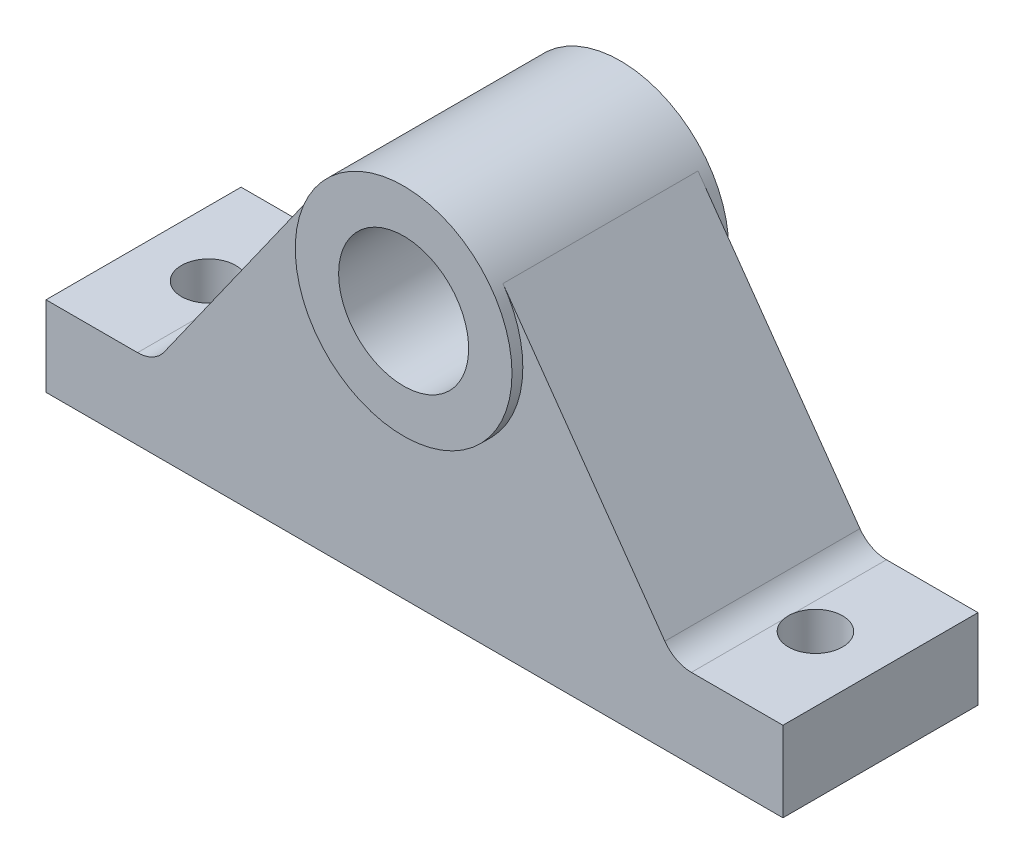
SolidWorks part; units mm, degrees
ref_plane "前视基准面" through (0, 0, 0) normal (0, 0, 1) x (1, 0, 0)
ref_plane "上视基准面" through (0, 0, 0) normal (0, 1, 0) x (1, 0, 0)
ref_plane "右视基准面" through (0, 0, 0) normal (1, 0, 0) x (0, 0, -1)
sketch "草图1" plane through (0, 0, 0) normal (0, 0, 1) x (1, 0, 0)
  line L0 (0, 0) -> (0, 164.8448) construction
  line L1 (-170, 0) -> (-120, 0)
  line L2 (-170, 0) -> (-170, -37)
  line L3 (-170, -37) -> (170, -37)
  line L4 (170, 0) -> (170, -37)
  line L5 (-40.8123, 111.8852) -> (-120, 0)
  line L6 (40.8123, 111.8852) -> (120, 0)
  line L7 (120, 0) -> (170, 0)
  arc A0 (40.8123, 111.8852) -> (-40.8123, 111.8852) centre (0, 83) ccw
  circle A1 centre (0, 83) radius 30
  dimension "D3" = 120
  dimension "D4" = 100
  dimension "D5" = 60
  dimension "D1" = 340
  dimension "D2" = 37
  dimension "D6" = 120
  dimension "D7" = 120
  dimension "D8" = 170
extrude "拉伸1" add sketch "草图1" along normal mid plane 90
sketch "草图3" plane through (0, 0, 45) normal (0, 0, 1) x (1, 0, 0)
  circle A0 centre (0, 83) radius 50
  circle A1 centre (0, 83) radius 30
  dimension "D1" = 100
  dimension "D2" = 60
extrude "拉伸2" add sketch "草图3" along normal blind 5
mirror "镜向1" about plane through (0, 0, 0) normal (0, 0, 1) of "拉伸2"
fillet "圆角1" radius 15 2 edges at (120, 0, 0) (-120, 0, 0)
sketch "草图4" plane through (0, -37, 0) normal (0, -1, 0) x (1, 0, 0)
  line L0 (-213.1994, 0) -> (189.8295, 0) construction
  circle A0 centre (-140, 0) radius 12.5
  circle A1 centre (140, 0) radius 12.5
  dimension "D1" = 280
  dimension "D2" = 140
  dimension "D3" = 25
  dimension "D4" = 25
extrude "切除-拉伸1" cut sketch "草图4" against normal through all
